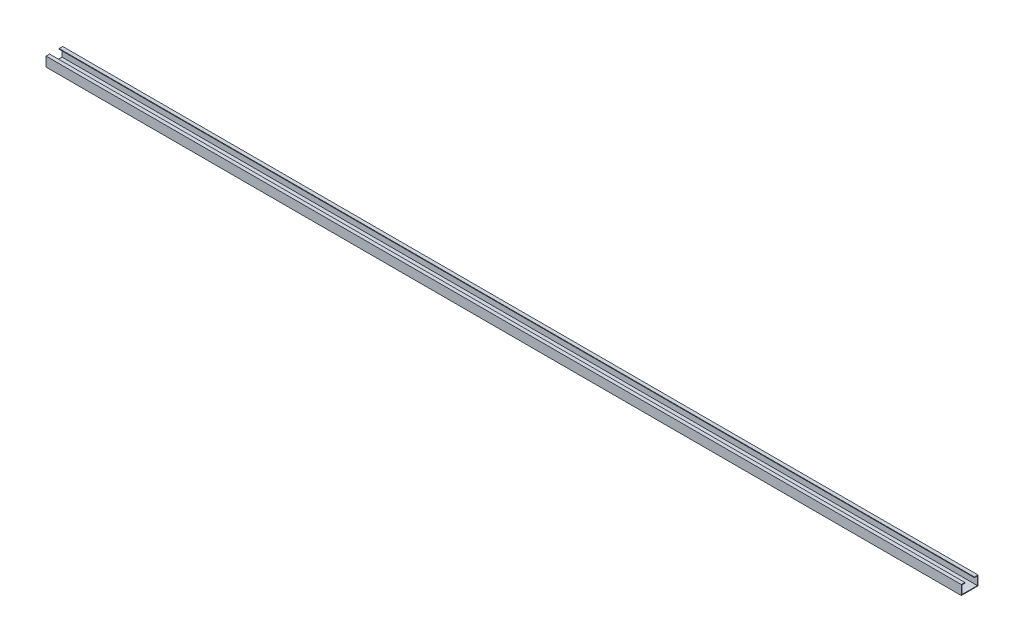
SolidWorks part; units mm, degrees
ref_plane "Front Plane" through (0, 0, 0) normal (0, 0, 1) x (1, 0, 0)
ref_plane "Top Plane" through (0, 0, 0) normal (0, 1, 0) x (1, 0, 0)
ref_plane "Right Plane" through (0, 0, 0) normal (1, 0, 0) x (0, 0, -1)
sketch "Sketch1" plane through (0, 0, 0) normal (1, 0, 0) x (0, 0, -1)
  line L0 (-22.225, 0) -> (22.225, 0)
  line L1 (22.225, 0) -> (22.225, 25.4)
  line L2 (22.225, 25.4) -> (12.7, 25.4)
  line L3 (-22.225, 0) -> (-22.225, 25.4)
  line L4 (-22.225, 25.4) -> (-12.7, 25.4)
  dimension "D1" = 44.45
  dimension "D2" = 25.4
  dimension "D3" = 25.4
extrude "Extrude-Thin1" add sketch "Sketch1" along normal blind 2438.4 thin
